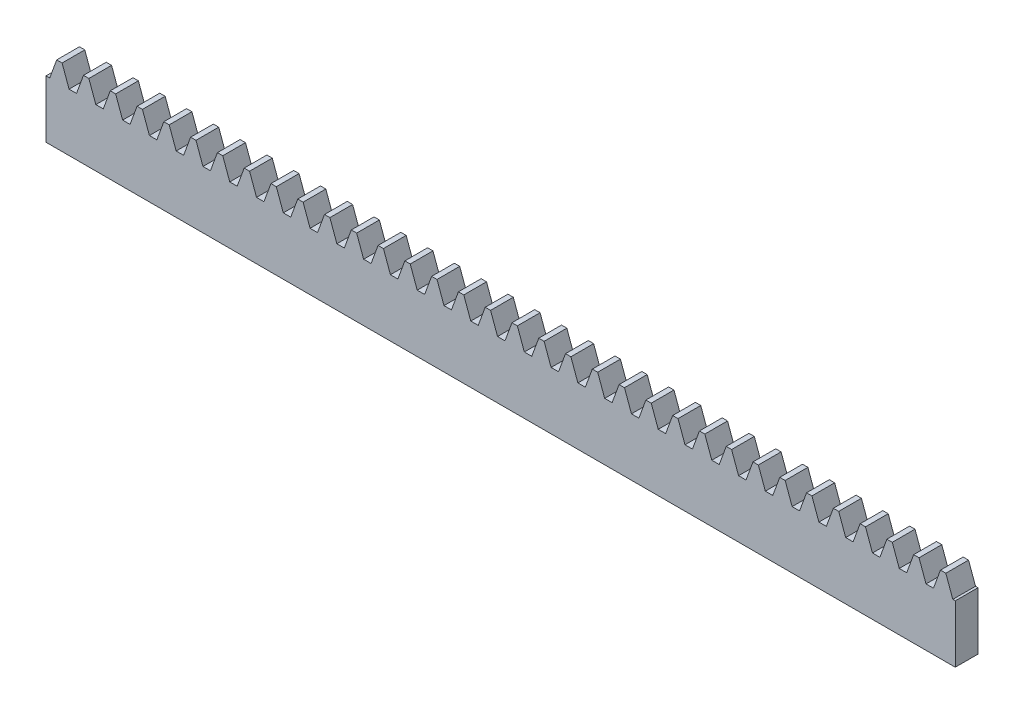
SolidWorks part; units mm, degrees
ref_plane "Plane1" through (0, 0, 0) normal (0, 0, 1) x (1, 0, 0)
ref_plane "Plane2" through (0, 0, 0) normal (0, 1, 0) x (1, 0, 0)
ref_plane "Plane3" through (0, 0, 0) normal (1, 0, 0) x (0, 0, -1)
sketch "HoldingSke" plane through (0, 0, 0) normal (0, 1, 0) x (1, 0, 0)
  line L0 (0, 0) -> (0.0928, 0.6602)
  line L1 (-15, 0) -> (100, 0) construction
  line L2 (0, 0) -> (-2.1039, 2.3779)
  line L3 (0, 0) -> (-11.863, 4.5341)
  line L4 (0, 0) -> (7.0742, 4.9534)
  line L5 (0, 0) -> (-23.7986, -8.8762)
  line L6 (0, 0) -> (-10.5278, -7.1032)
  line L9 (-71.009, 38.7566) -> (79.3418, 93.4798)
  line L10 (-76.2, 3.8779) -> (-64.2, 3.8779)
  line L11 (0, 0) -> (-4, 0)
  line L12 (-76.2, 101.6) -> (-76.147, 101.6)
  line L13 (24.9733, 27.94) -> (52.9518, 28.4284)
  line L14 (24.9733, 27.94) -> (24.9743, 27.94)
  line L15 (24.9733, 27.94) -> (100.4006, 29.5858)
  circle A0 centre (0, 0) radius 19.05
  circle A1 centre (0, 0) radius 6
  circle A2 centre (0, 0) radius 12.7
  dimension "MPH" = 12
  dimension "Diameter" = 38.1
  dimension "Num_teeth" = 35
  dimension "Pitch" = 0.6667
  dimension "Width" = 4
  dimension "Show_teeth" = 998
  dimension "Thickness" = 12.7
  dimension "Ap" = 20
  dimension "Pitch_height" = 12
  dimension "Backlash" = 0.053
  dimension "Addendum_fac" = 1
  dimension "Dedendum_fac" = 1.25
  dimension "Clearance_fac" = 0.25
  dimension "Dedendum_add" = 0.001
  dimension "Length" = 160
  dimension "Module" = 1.5
sketch "BlankSke" plane through (0, 0, 0) normal (0, 0, 1) x (1, 0, 0)
  line L1 (0, 0) -> (160, 0)
  line L2 (0, 0) -> (0, 13.5)
  line L3 (0, 13.5) -> (160, 13.5)
  line L4 (160, 0) -> (160, 13.5)
  dimension "Length" = 160
  dimension "Blank_height" = 13.5
extrude "Blank" add sketch "BlankSke" against normal blind 4
sketch "TooCutSkeIll" plane through (0, 0, 0) normal (0, 0, 1) x (1, 0, 0)
  line L0 (-1.8687, 13.4605) -> (-0.7447, 10.3724)
  line L1 (-0.3914, 10.125) -> (0.3914, 10.125)
  line L2 (0.7447, 10.3724) -> (1.8687, 13.4605)
  line L3 (160, 13.5) -> (0, 13.5) construction
  line L4 (0, 0) -> (0, 64.897) construction
  line L5 (-13.208, 12) -> (12.954, 12) construction
  line L6 (0, 0) -> (160, 0) construction
  line L7 (1.3371, 12) -> (1.3371, 48.7463) construction
  line L8 (-1.3371, 12) -> (-1.3371, 48.7463) construction
  line L9 (1.9251, 13.5) -> (1.9251, 13.5254)
  line L10 (-1.9251, 13.5) -> (-1.9251, 13.5254)
  line L11 (-1.9251, 13.5254) -> (1.9251, 13.5254)
  arc A0 (0.3914, 10.125) -> (0.7447, 10.3724) centre (0.3914, 10.501) ccw
  arc A1 (-0.7447, 10.3724) -> (-0.3914, 10.125) centre (-0.3914, 10.501) ccw
  arc A2 (1.9251, 13.5) -> (1.8687, 13.4605) centre (1.9251, 13.44) ccw
  arc A3 (-1.8687, 13.4605) -> (-1.9251, 13.5) centre (-1.9251, 13.44) ccw
  dimension "Root_fillet" = 0.376
  dimension "Break_rad" = 0.06
  dimension "Pitch_height" = 12
  dimension "Gap_width" = 2.6742
  dimension "Dedendum" = 1.875
  dimension "Addendum_plus" = 1.5254
  dimension "Pressure_angle" = 20
extrude "ToothCutIll" [suppressed] cut sketch "TooCutSkeIll" against normal through all
sketch "TooCutSkeSim" plane through (0, 0, 0) normal (0, 0, 1) x (1, 0, 0)
  line L0 (0.6547, 10.125) -> (-0.6547, 10.125)
  line L1 (1.8923, 13.5254) -> (0.6547, 10.125)
  line L2 (0, 17.4625) -> (0, 53.467) construction
  line L3 (1.8923, 13.5254) -> (-1.8923, 13.5254)
  line L6 (-1.8923, 13.5254) -> (-0.6547, 10.125)
  line L9 (-1.3371, 12) -> (1.3371, 12) construction
  line L10 (0, 0) -> (160, 0) construction
  line L11 (1.3371, 12) -> (1.3371, 53.467) construction
  line L12 (-1.3371, 12) -> (-1.3371, 53.467) construction
  dimension "Pitch_height" = 12
  dimension "Pressure_angle" = 20
  dimension "Gap_width" = 2.6742
  dimension "Dedendum" = 1.875
  dimension "Addendum_plus" = 1.5254
extrude "ToothCutSim" cut sketch "TooCutSkeSim" against normal through all
pattern_linear "TeethCuts" count 35 spacing 4.7124 along (1, 0, 0) of "ToothCutIll", "ToothCutSim"
equation "' \"Module@HoldingSke\" = 6.35"
equation "' \"Num_teeth@HoldingSke\" = 12"
equation "' \"Ap@HoldingSke\" =  20"
equation "' \"Width@HoldingSke\" = 0.25 * 25.4"
equation "' \"Show_teeth@HoldingSke\" = 500"
equation "' \"Backlash@HoldingSke\" = 0.009 * 25.4"
equation "' \"Addendum_fac@HoldingSke\" = 1.0"
equation "' \"Dedendum_fac@HoldingSke\" = 1.25"
equation "' \"Dedendum_add@HoldingSke\" = 0.00005 * 25.4"
equation "' \"Clearance_fac@HoldingSke\" = 0.25"
equation "' \"Pitch_height@HoldingSke\" = 1 * 25.4"
equation "' \"Length@HoldingSke\" = 4.71 * 25.4"
equation "\"Pitch@HoldingSke\" = 1 / \"Module@HoldingSke\""
equation "\"MPH@HoldingSke\" = \"Dedendum_fac@HoldingSke\" / \"Pitch@HoldingSke\" + 2 * \"Dedendum_add@HoldingSke\" + 0.002 * 25.4"
equation "\"MPH@HoldingSke\" = ((sgn( \"MPH@HoldingSke\" - \"Pitch_height@HoldingSke\")+1)*( \"MPH@HoldingSke\" - \"Pitch_height@HoldingSke\"))/2 + \"Pitch_height@HoldingSke\""
equation "\"Blank_height@BlankSke\" = \"Pitch_height@HoldingSke\" + \"Addendum_fac@HoldingSke\"  / \"Pitch@HoldingSke\" "
equation "\"Length@BlankSke\" =  \"Length@HoldingSke\""
equation "\"Face_width@Blank\" = \"Width@HoldingSke\""
equation "\"Pressure_angle@TooCutSkeIll\" = \"Ap@HoldingSke\""
equation "\"Addendum_plus@TooCutSkeIll\" =  \"Addendum_fac@HoldingSke\"  / \"Pitch@HoldingSke\" + 0.001 *25.4"
equation "\"Dedendum@TooCutSkeIll\" = \"Dedendum_fac@HoldingSke\"  / \"Pitch@HoldingSke\""
equation "\"Pitch_height@TooCutSkeIll\" =  \"MPH@HoldingSke\""
equation "\"Gap_width@TooCutSkeIll\" = 3.14159265 / 2 / \"Pitch@HoldingSke\" + 6 * \"Backlash@HoldingSke\""
equation "\"Pressure_angle@TooCutSkeSim\" = \"Ap@HoldingSke\""
equation "\"Addendum_plus@TooCutSkeSim\" =  \"Addendum_fac@HoldingSke\"  / \"Pitch@HoldingSke\" + 0.001 * 25.4"
equation "\"Dedendum@TooCutSkeSim\" = \"Dedendum_fac@HoldingSke\"  / \"Pitch@HoldingSke\""
equation "\"Pitch_height@TooCutSkeSim\" =  \"MPH@HoldingSke\""
equation "\"Gap_width@TooCutSkeSim\" = 3.14159265 / 2 / \"Pitch@HoldingSke\" + 6 * \"Backlash@HoldingSke\""
equation "\"Root_fillet@TooCutSkeIll\" = \"Clearance_fac@HoldingSke\" / \"Pitch@HoldingSke\" + \"Dedendum_add@HoldingSke\""
equation "\"Break_rad@TooCutSkeIll\" = 0.02 / \"Pitch@HoldingSke\" * 2"
equation "\"Linear_pitch@TeethCuts\" = 3.14159265 / \"Pitch@HoldingSke\""
equation "\"Num_teeth@HoldingSke\" = int( ( \"Length@HoldingSke\" + 0 ) / (3.14159265 / \"Pitch@HoldingSke\")) + 0.9999  + 1"
equation " \"Num_teeth@TeethCuts\" = int( \"Show_teeth@HoldingSke\" ) + 1"
equation " \"Num_teeth@TeethCuts\" = ((sgn( \"Num_teeth@TeethCuts\" - \"Num_teeth@HoldingSke\" )-1)*( \"Num_teeth@TeethCuts\" - \"Num_teeth@HoldingSke\" ))/-2+ \"Num_teeth@HoldingSke\""
equation " \"Num_teeth@TeethCuts\" = ((sgn( \"Num_teeth@TeethCuts\" - 2.0)+1)*( \"Num_teeth@TeethCuts\" - 2.0))/2 +2.0"
